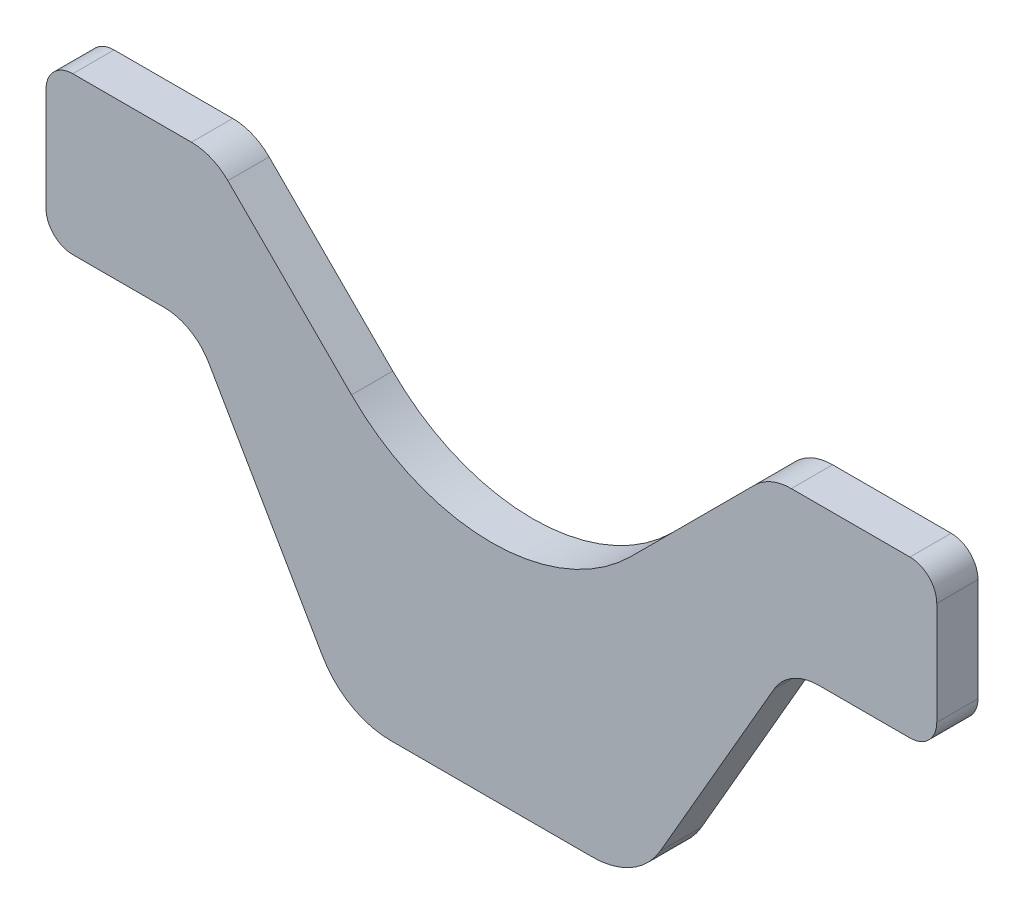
SolidWorks part; units mm, degrees
ref_plane "Plan de face" through (0, 0, 0) normal (0, 0, 1) x (1, 0, 0)
ref_plane "Plan de dessus" through (0, 0, 0) normal (0, 1, 0) x (1, 0, 0)
ref_plane "Plan de droite" through (0, 0, 0) normal (1, 0, 0) x (0, 0, -1)
sketch "Esquisse1" plane through (0, 0, 0) normal (0, 0, 1) x (1, 0, 0)
  line L0 (0, 0) -> (0, 67.8543) construction
  line L1 (24.5, 0) -> (-24.5, 0)
  line L2 (-40.9545, 9.5) -> (-68.523, 57.25)
  line L3 (-79.3483, 63.5) -> (-101.5, 63.5)
  line L4 (-108, 70) -> (-108, 95)
  line L5 (-101.5, 101.5) -> (-72.7374, 101.5)
  line L6 (-63.8986, 97.8388) -> (-33.9141, 67.8543)
  line L7 (63.8986, 97.8388) -> (33.9141, 67.8543)
  line L8 (101.5, 101.5) -> (72.7374, 101.5)
  line L9 (108, 70) -> (108, 95)
  line L10 (79.3483, 63.5) -> (101.5, 63.5)
  line L11 (40.9545, 9.5) -> (68.523, 57.25)
  arc A0 (-33.9141, 67.8543) -> (33.9141, 67.8543) centre (0, 101.7683) ccw
  arc A1 (-68.523, 57.25) -> (-79.3483, 63.5) centre (-79.3483, 51) ccw
  arc A2 (-72.7374, 101.5) -> (-63.8986, 97.8388) centre (-72.7374, 89) cw
  arc A3 (-101.5, 63.5) -> (-108, 70) centre (-101.5, 70) cw
  arc A4 (-108, 95) -> (-101.5, 101.5) centre (-101.5, 95) cw
  arc A5 (-24.5, 0) -> (-40.9545, 9.5) centre (-24.5, 19) cw
  arc A7 (24.5, 0) -> (40.9545, 9.5) centre (24.5, 19) ccw
  arc A8 (108, 95) -> (101.5, 101.5) centre (101.5, 95) ccw
  arc A9 (101.5, 63.5) -> (108, 70) centre (101.5, 70) ccw
  arc A10 (72.7374, 101.5) -> (63.8986, 97.8388) centre (72.7374, 89) ccw
  arc A11 (68.523, 57.25) -> (79.3483, 63.5) centre (79.3483, 51) cw
  dimension "D7" = 12.5
  dimension "D8" = 6.5
  dimension "D9" = 19
  dimension "D1" = 101.5
  dimension "D2" = 63.5
  dimension "D3" = 60
  dimension "D4" = 45
  dimension "D5" = 108
  dimension "D10" = 24.5
extrude "Boss.-Extru.1" add sketch "Esquisse1" along normal blind 10
